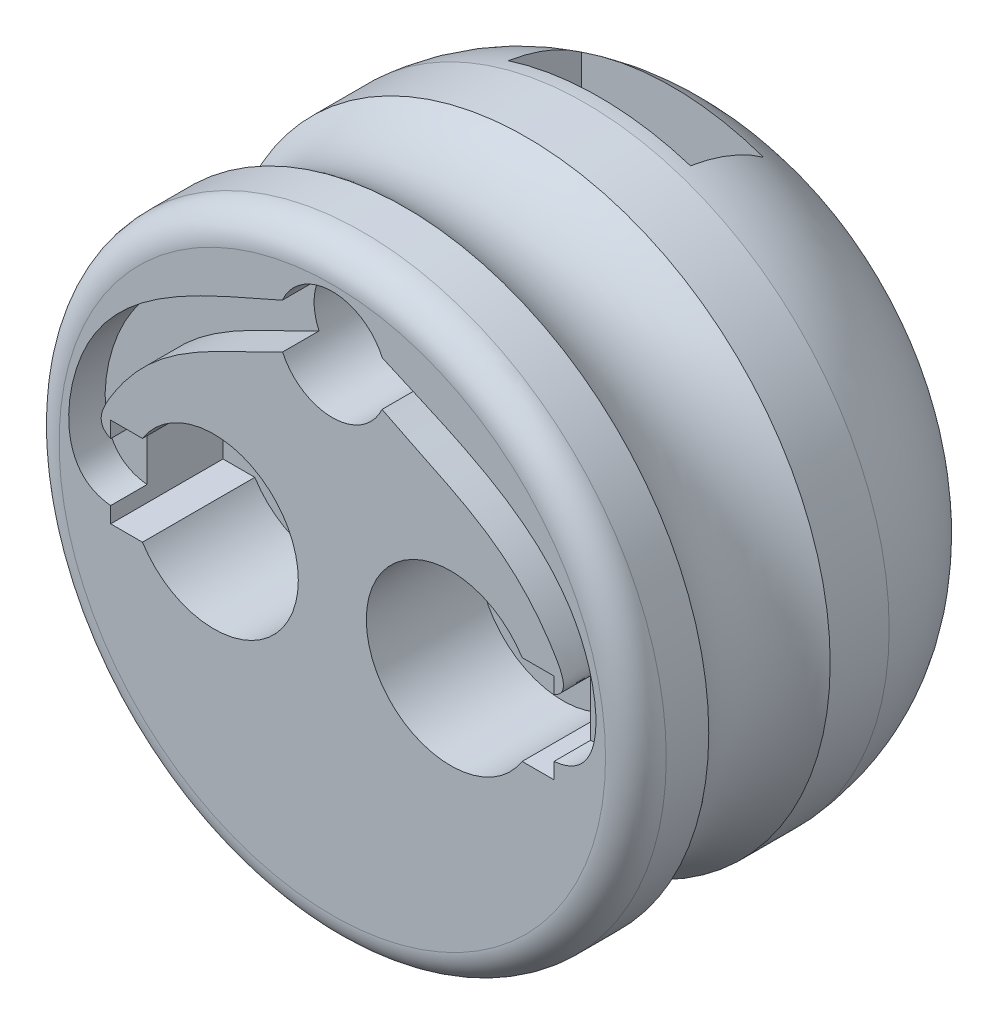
SolidWorks part; units mm, degrees
ref_plane "Plan de face" through (0, 0, 0) normal (0, 0, 1) x (1, 0, 0)
ref_plane "Plan de dessus" through (0, 0, 0) normal (0, 1, 0) x (1, 0, 0)
ref_plane "Plan de droite" through (0, 0, 0) normal (1, 0, 0) x (0, 0, -1)
sketch "Esquisse1" plane through (0, 0, 0) normal (0, 0, 1) x (1, 0, 0)
  circle A0 centre (0, 0) radius 50
  dimension "D1" = 100
extrude "Boss.-Extru.1" add sketch "Esquisse1" along normal blind 65
ref_axis "Axe1" through (0, 0, 65) along (0, 0, -1)
sketch "Esquisse2" plane through (0, 0, 0) normal (1, 0, 0) x (0, 0, -1)
  line L0 (-65, -50) -> (0, -50) construction
  line L1 (0, -35.7883) -> (7.5822, -43.3705)
  line L2 (7.5822, -43.3705) -> (-5.1795, -64.7597)
  line L3 (-5.1795, -64.7597) -> (-23.2867, -50)
  spline S0 degree 2 poles (-23.2867, -50) (-8.1784, -48.6758) (0, -35.7883) knots 0 0 0 1 1 1
revolve "Enlèvement de matière-Révolution1" cut sketch "Esquisse2" angle 360 about axis through (0, 0, 65) along (0, 0, -1)
sketch "Esquisse3" plane through (0, 0, 0) normal (1, 0, 0) x (0, 0, -1)
  line L0 (-65, -50) -> (-23.2867, -50) construction
  line L1 (-65, 50) -> (-65, -50) construction
  line L2 (-53, -50) -> (-53, -60.7319)
  line L3 (-53, -60.7319) -> (-33, -61.2456)
  line L4 (-33, -61.2456) -> (-33, -50)
  arc A0 (-33, -50) -> (-53, -50) centre (-43, -62.49) ccw
  dimension "D1" = 20
  dimension "D2" = 12
revolve "Enlèvement de matière-Révolution2" cut sketch "Esquisse3" angle 360 about axis through (0, 0, 65) along (0, 0, -1)
fillet "Congé1" radius 5 1 edges at (50, 0, 65)
sketch "Esquisse4" plane through (0, 0, 65) normal (0, 0, 1) x (1, 0, 0)
  line L0 (-72.6416, 0) -> (-57.8416, 0) construction
  line L2 (-36.5, 7.4) -> (-31.2665, 7.4)
  line L3 (-36.5, 7.4) -> (-36.5, -7.4)
  line L4 (-36.5, -7.4) -> (-31.2665, -7.4)
  line L6 (36.5, 7.4) -> (31.2665, 7.4)
  line L7 (36.5, 7.4) -> (36.5, -7.4)
  line L8 (36.5, -7.4) -> (31.2665, -7.4)
  arc A0 (-31.2665, -7.4) -> (-31.2665, 7.4) centre (-19.5, 0) ccw
  arc A1 (31.2665, 7.4) -> (31.2665, -7.4) centre (19.5, 0) ccw
  circle A2 centre (-11.5, 0) radius 1.5 construction
  circle A3 centre (11.5, 0) radius 1.5 construction
  dimension "D2" = 3
  dimension "D3" = 3
  dimension "D4" = 27.8
  dimension "D5" = 27.8
  dimension "D6" = 8
  dimension "D7" = 8
  dimension "D11" = 23
  dimension "D12" = 11.5
  dimension "D8" = 14.8
  dimension "D9" = 7.4
  dimension "D10" = 17
  dimension "D13" = 14.8
  dimension "D14" = 17
  dimension "D15" = 7.4
extrude "Enlèv. mat.-Extru.1" cut sketch "Esquisse4" against normal blind 18.5
ref_plane "Plan1" through (0, 57.8724, 0) normal (0, 1, 0) x (1, 0, 0)
sketch "Esquisse5" plane through (0, 0, 65) normal (0, 0, 1) x (1, 0, 0)
  line L0 (-36.5, 7.4) -> (-36.5, -7.4) construction
  line L1 (0, 0) -> (0, -40.5731) construction
  line L2 (-36.5, 4.7563) -> (-36.5, -4.7867)
  line L3 (36.5, 4.7563) -> (36.5, -4.7867)
  line L4 (-1.342, 42.0338) -> (1.342, 42.0338)
  line L5 (2.0875, 34.7274) -> (-2.0875, 34.7274)
  spline S0 degree 3 poles (-36.5, 4.7563) (-39.1824, 5.8962) (-29.7397, 24.5928) (-16.07, 26.0231) (-2.0875, 34.7274) knots 0 0 0 0 0.137788 1 1 1 1
  spline S1 degree 3 poles (-36.5, -4.7867) (-44.3309, -4.0424) (-44.4025, 28.599) (-15.3144, 34.2569) (-1.342, 42.0338) knots 0 0 0 0 0.272915 1 1 1 1
  spline S2 degree 3 poles (36.5, -4.7867) (44.3309, -4.0424) (44.4025, 28.599) (15.3144, 34.2569) (1.342, 42.0338) knots 0 0 0 0 0.272915 1 1 1 1
  spline S3 degree 3 poles (36.5, 4.7563) (39.1824, 5.8962) (29.7397, 24.5928) (16.07, 26.0231) (2.0875, 34.7274) knots 0 0 0 0 0.137788 1 1 1 1
  point P25 (-25.653, 22.101)
extrude "Enlèv. mat.-Extru.2" cut sketch "Esquisse5" against normal blind 6
sketch "Esquisse6" plane through (0, 0, 65) normal (0, 0, 1) x (1, 0, 0)
  circle A0 centre (0, 35) radius 9
  dimension "D1" = 18
  dimension "D2" = 35
extrude "Enlèv. mat.-Extru.3" cut sketch "Esquisse6" against normal blind 56
sketch "Esquisse7" plane through (0, 57.8724, 0) normal (0, 1, 0) x (1, 0, 0)
  line L0 (0, -65) -> (0, 0) construction
  line L1 (15, -9) -> (-15, -9)
  line L2 (15, -9) -> (15, -21)
  line L3 (15, -21) -> (-15, -21)
  line L4 (-15, -9) -> (-15, -21)
  dimension "D1" = 30
  dimension "D2" = 15
  dimension "D3" = 12
extrude "Enlèv. mat.-Extru.4" cut sketch "Esquisse7" against normal blind 32
sketch "Esquisse8" plane through (0, 0, 0) normal (0, 0, -1) x (-1, 0, 0)
  circle A0 centre (0, 0) radius 28
  dimension "D1" = 56
extrude "Enlèv. mat.-Extru.5" cut sketch "Esquisse8" against normal blind 42
